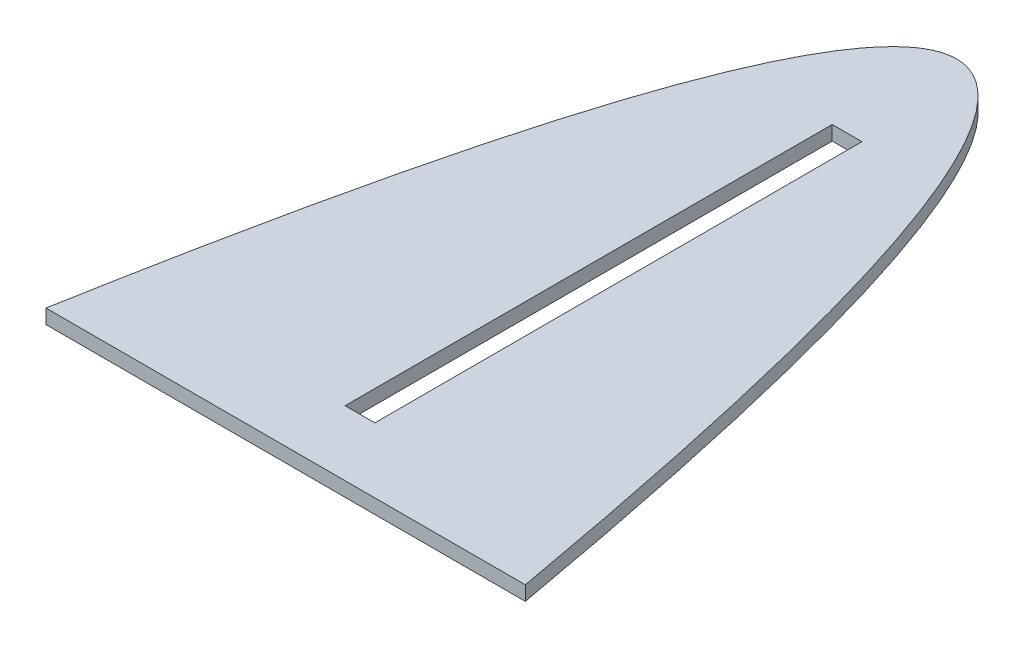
SolidWorks part; units mm, degrees
ref_plane "Plan de face" through (0, 0, 0) normal (0, 0, 1) x (1, 0, 0)
ref_plane "Plan de dessus" through (0, 0, 0) normal (0, 1, 0) x (1, 0, 0)
ref_plane "Plan de droite" through (0, 0, 0) normal (1, 0, 0) x (0, 0, -1)
sketch "Esquisse2" plane through (0, 0, 0) normal (0, 1, 0) x (1, 0, 0)
  line L0 (0, 0) -> (100, 0)
  spline S0 degree 2 poles (0, 0) (50, 280) (100, 0) knots 0 0 0 1 1 1
  point P4 (50, 0)
  dimension "D1" = 100
  dimension "D2" = 140
extrude "Boss.-Extru.1" add sketch "Esquisse2" along normal blind 3
sketch "Esquisse3" plane through (0, 3, 0) normal (0, 1, 0) x (1, 0, 0)
  line L1 (48.8515, 115.1713) -> (55.0515, 115.1713)
  line L2 (48.8515, 115.1713) -> (48.8515, 13.5606)
  line L3 (48.8515, 13.5606) -> (55.0515, 13.5606)
  line L4 (55.0515, 115.1713) -> (55.0515, 13.5606)
  dimension "D1" = 6.2
extrude "Enlèv. mat.-Extru.1" cut sketch "Esquisse3" against normal up to next
